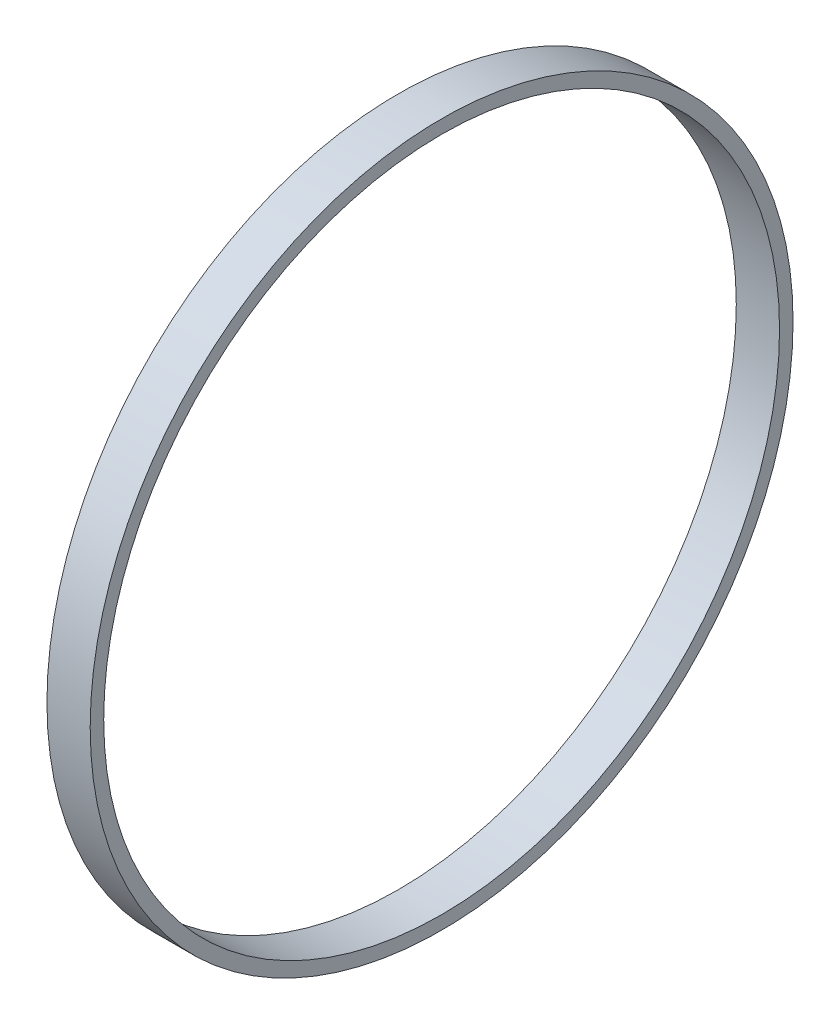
SolidWorks part; units mm, degrees
ref_plane "Front Plane" through (0, 0, 0) normal (1, 0, 0) x (0, 1, 0)
ref_plane "Top Plane" through (0, 0, 0) normal (0, 0, 1) x (0, 1, 0)
ref_plane "Right Plane" through (0, 0, 0) normal (0, 1, 0) x (-1, 0, 0)
sketch "Sketch1" plane through (0, 0, 0) normal (1, 0, 0) x (0, 1, 0)
  circle A0 centre (0, 0) radius 82.55
  circle A1 centre (0, 0) radius 79.375
extrude "Circular_section" add sketch "Sketch1" along normal blind 10.16
